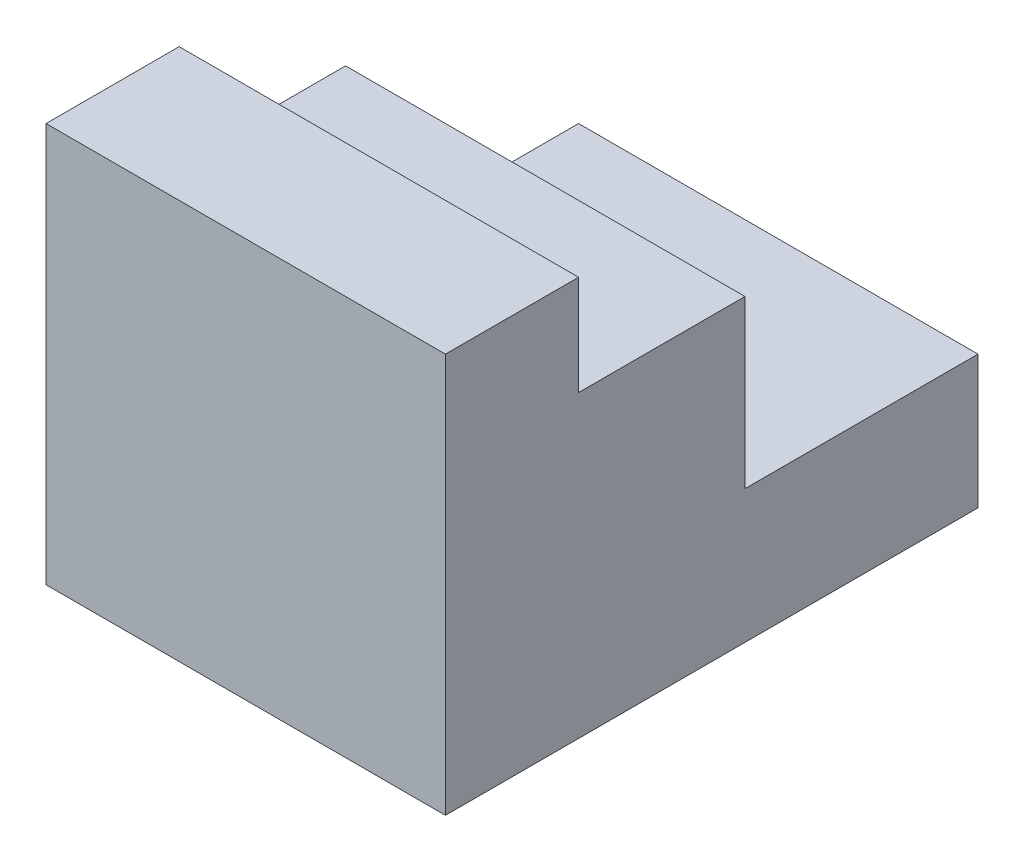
SolidWorks part; units mm, degrees
ref_plane "Ebene vorne" through (0, 0, 0) normal (0, 0, 1) x (1, 0, 0)
ref_plane "Ebene oben" through (0, 0, 0) normal (0, 1, 0) x (1, 0, 0)
ref_plane "Ebene rechts" through (0, 0, 0) normal (1, 0, 0) x (0, 0, -1)
sketch "Skizze1" plane through (0, 0, 0) normal (1, 0, 0) x (0, 0, -1)
  line L0 (0, 0) -> (0, 60)
  line L1 (0, 60) -> (20, 60)
  line L2 (20, 60) -> (20, 45)
  line L3 (20, 45) -> (45, 45)
  line L4 (45, 45) -> (45, 20)
  line L5 (45, 20) -> (80, 20)
  line L6 (80, 20) -> (80, 0)
  line L7 (80, 0) -> (0, 0)
  dimension "D1" = 80
  dimension "D2" = 35
  dimension "D3" = 20
  dimension "D4" = 60
  dimension "D5" = 20
  dimension "D6" = 15
extrude "Aufsatz-Linear austragen1" add sketch "Skizze1" along normal blind 60
